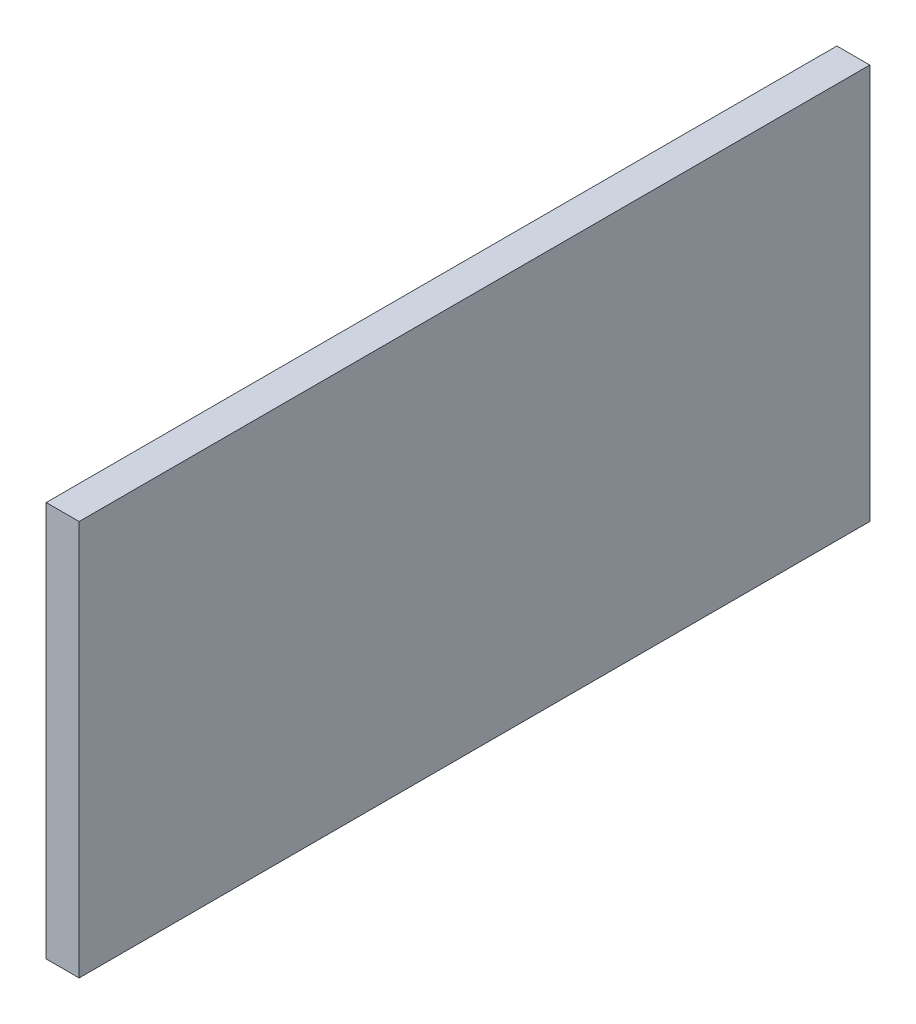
SolidWorks part; units mm, degrees
ref_plane "Front Plane" through (0, 0, 0) normal (0, 0, 1) x (1, 0, 0)
ref_plane "Top Plane" through (0, 0, 0) normal (0, 1, 0) x (1, 0, 0)
ref_plane "Right Plane" through (0, 0, 0) normal (1, 0, 0) x (0, 0, -1)
sketch "Sketch1" plane through (0, 0, 0) normal (0, 1, 0) x (1, 0, 0)
  line L0 (0, 0) -> (50.8, 0)
  line L1 (50.8, 0) -> (50.8, -50.8)
  line L2 (50.8, -50.8) -> (101.6, -50.8)
  line L3 (101.6, -50.8) -> (101.6, 1168.4)
  line L4 (101.6, 1168.4) -> (50.8, 1168.4)
  line L5 (50.8, 1168.4) -> (50.8, 1117.6)
  line L6 (50.8, 1117.6) -> (0, 1117.6)
  line L7 (0, 1117.6) -> (0, 0)
  dimension "D1" = 1219.2
  dimension "D2" = 1117.6
  dimension "D3" = 50.8
  dimension "D4" = 50.8
  dimension "D5" = 50.8
extrude "Boss-Extrude1" add sketch "Sketch1" along normal blind 609.6
sketch "Sketch2" plane through (0, 0, 0) normal (0, 0, 1) x (1, 0, 0)
  line L0 (50.8, 609.6) -> (50.8, 0) construction
  line L1 (0, 609.6) -> (50.8, 609.6)
  line L2 (0, 609.6) -> (0, 533.4)
  line L3 (0, 533.4) -> (50.8, 533.4)
  line L4 (50.8, 609.6) -> (50.8, 533.4)
  dimension "D1" = 76.2
extrude "Cut-Extrude1" cut sketch "Sketch2" against normal up to next
sketch "Sketch3" plane through (0, 0, 0) normal (-1, 0, 0) x (0, 0, 1)
  line L0 (50.8, 609.6) -> (50.8, 0) construction
  line L1 (-393.5854, 266.7) -> (-317.3854, 266.7)
  line L2 (-393.5854, 266.7) -> (-393.5854, 193.04)
  line L3 (-393.5854, 193.04) -> (-317.3854, 193.04)
  line L4 (-317.3854, 266.7) -> (-317.3854, 193.04)
  line L5 (-1117.6, 0) -> (0, 0) construction
  dimension "D1" = 76.2
  dimension "D2" = 73.66
  dimension "D3" = 368.1854
  dimension "D4" = 266.7
extrude "Cut-Extrude2" cut sketch "Sketch3" against normal blind 50.8
